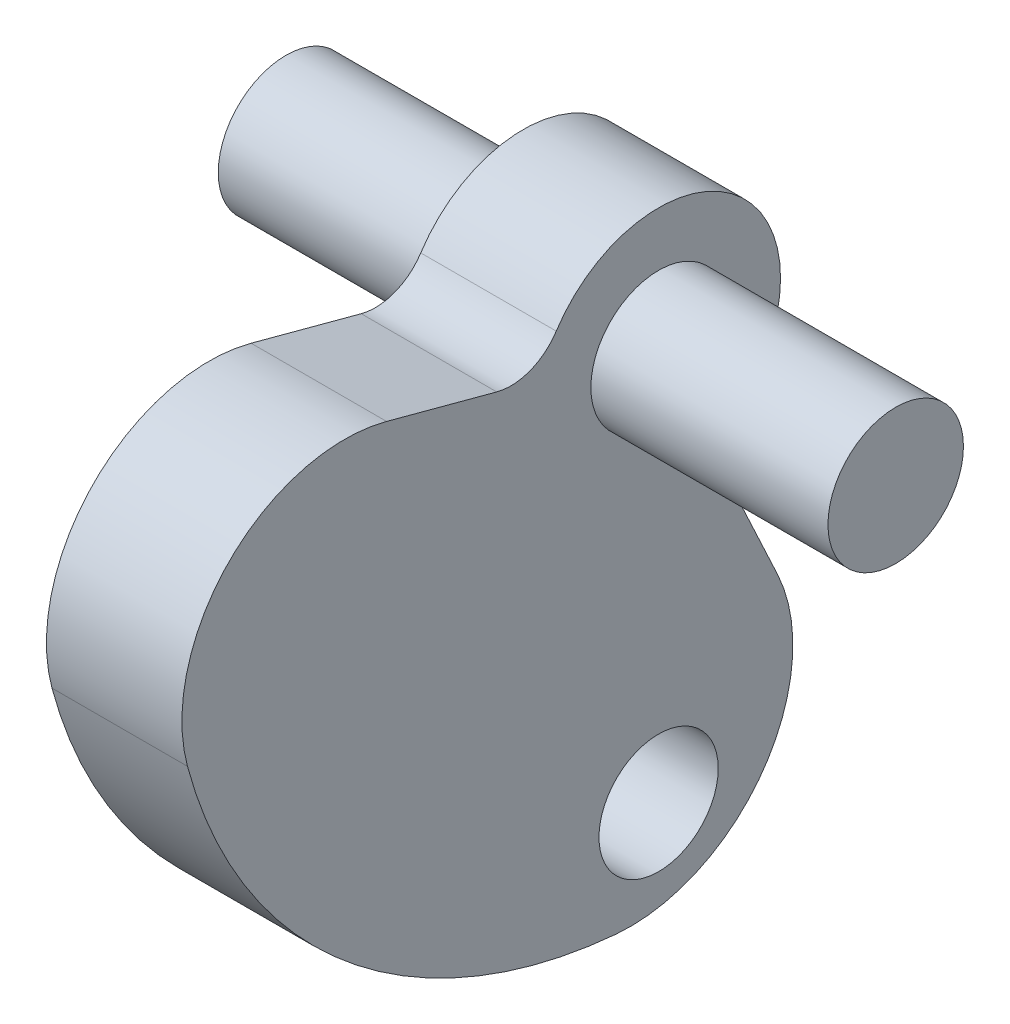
SolidWorks part; units mm, degrees
ref_plane "Front Plane" through (0, 0, 0) normal (0, 0, 1) x (1, 0, 0)
ref_plane "Top Plane" through (0, 0, 0) normal (0, 1, 0) x (1, 0, 0)
ref_plane "Right Plane" through (0, 0, 0) normal (1, 0, 0) x (0, 0, -1)
sketch "Sketch1" plane through (0, 0, 0) normal (1, 0, 0) x (0, 0, -1)
  line L0 (0, 0) -> (37.6571, 0) construction
  line L1 (3.3195, -7.1186) -> (9.6611, -20.7182)
  line L2 (0, 0) -> (0, -69.3836) construction
  line L3 (-7.5869, 2.0329) -> (-22.0811, 5.9166)
  arc A0 (-4.7973, 3.1059) -> (3.8918, -4.1851) centre (0, 0) cw
  arc A1 (-22.0811, 5.9166) -> (9.6611, -20.7182) centre (0, 0) ccw
  circle A2 centre (0, -18.4404) radius 2.794
  arc A3 (-4.7973, 3.1059) -> (-7.5869, 2.0329) centre (-6.9295, 4.4863) cw
  arc A4 (3.8918, -4.1851) -> (3.3195, -7.1186) centre (5.6215, -6.0452) ccw
  dimension "D2" = 5.715
  dimension "D3" = 45.72
  dimension "D4" = 5.588
  dimension "D7" = 105
  dimension "D1" = 2.54
  dimension "D5" = 18.4404
  dimension "D6" = 65
extrude "Extrude1" add sketch "Sketch1" along normal mid plane 6.35
sketch "Sketch2" plane through (0, 0, 0) normal (1, 0, 0) x (0, 0, -1)
  circle A0 centre (0, 0) radius 3.175
  dimension "D1" = 6.35
extrude "Extrude2" add sketch "Sketch2" along normal mid plane 28.575
fillet "Fillet1" radius 7.62 2 edges at (0, -20.7182, -9.6611) (0, 5.9166, 22.0811)
